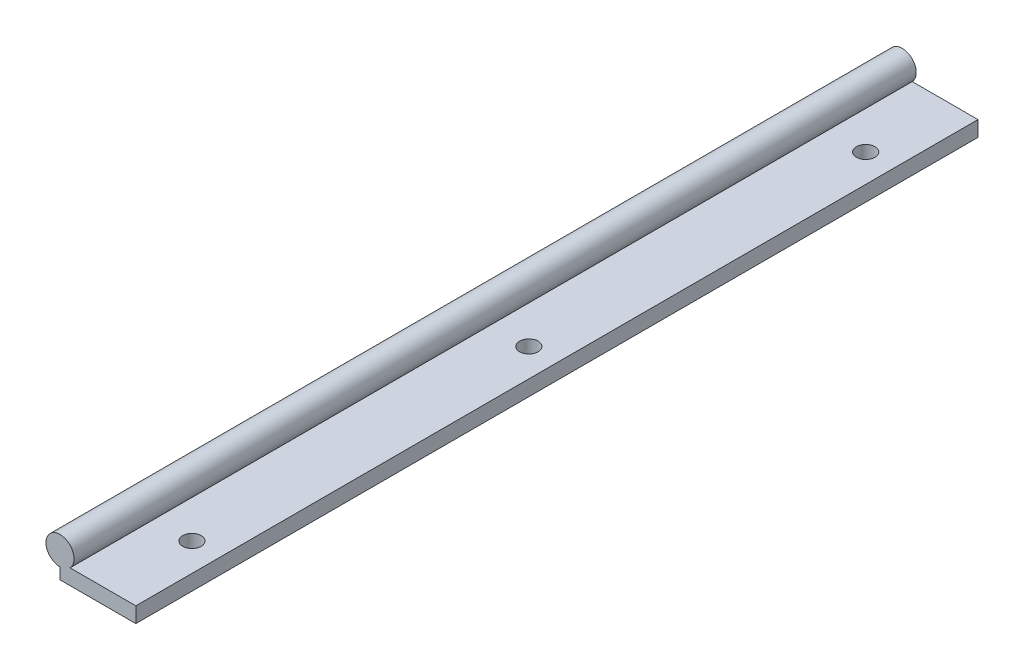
SolidWorks part; units mm, degrees
ref_plane "Alzado" through (0, 0, 0) normal (0, 0, 1) x (1, 0, 0)
ref_plane "Planta" through (0, 0, 0) normal (0, 1, 0) x (1, 0, 0)
ref_plane "Vista lateral" through (0, 0, 0) normal (1, 0, 0) x (0, 0, -1)
sketch "Croquis1" plane through (0, 0, 0) normal (0, 0, 1) x (1, 0, 0)
  line L1 (13.5, 2.75) -> (-9.9293, 2.75)
  line L2 (13.5, 2.75) -> (13.5, -2.75)
  line L3 (13.5, -2.75) -> (-13.5, -2.75)
  line L4 (-13.5, 1.25) -> (-13.5, -2.75)
  arc A0 (-13.5, 1.25) -> (-9.9293, 2.75) centre (-13.5, 6.25) cw
extrude "Extruir1" add sketch "Croquis1" along normal blind 300
sketch "Croquis7" plane through (0, 2.75, 0) normal (0, 1, 0) x (1, 0, 0)
  point P0 (3.5, -270)
  point P1 (3.5, -150)
  point P2 (3.5, -30)
hole_wizard "Taladro de diámetro de Ø6.6 (6.6)1" positions "Croquis3D1" profile "Croquis8" hole size "Ø6.6" standard "DIN"
sketch3d "Croquis3D1"
  point P0 (3.5, 2.75, 270)
  point P3 (3.5, 2.75, 150)
  point P6 (3.5, 2.75, 30)
sketch "Croquis8" plane through (3.5, 2.75, 270) normal (1, 0, 0) x (0, 0, 1)
  line L0 (0, 0) -> (0, 5.5)
  line L1 (0, 5.5) -> (3.3, 5.5)
  line L2 (3.3, 5.5) -> (3.3, 0)
  line L5 (3.3, 0) -> (0, 0)
  line L11 (0, -6.35) -> (0, 107.95) construction
  dimension "Diámetro de taladro hasta el siguiente" = 6.6
  dimension "Profundidad de taladro hasta el siguiente" = 5.5
